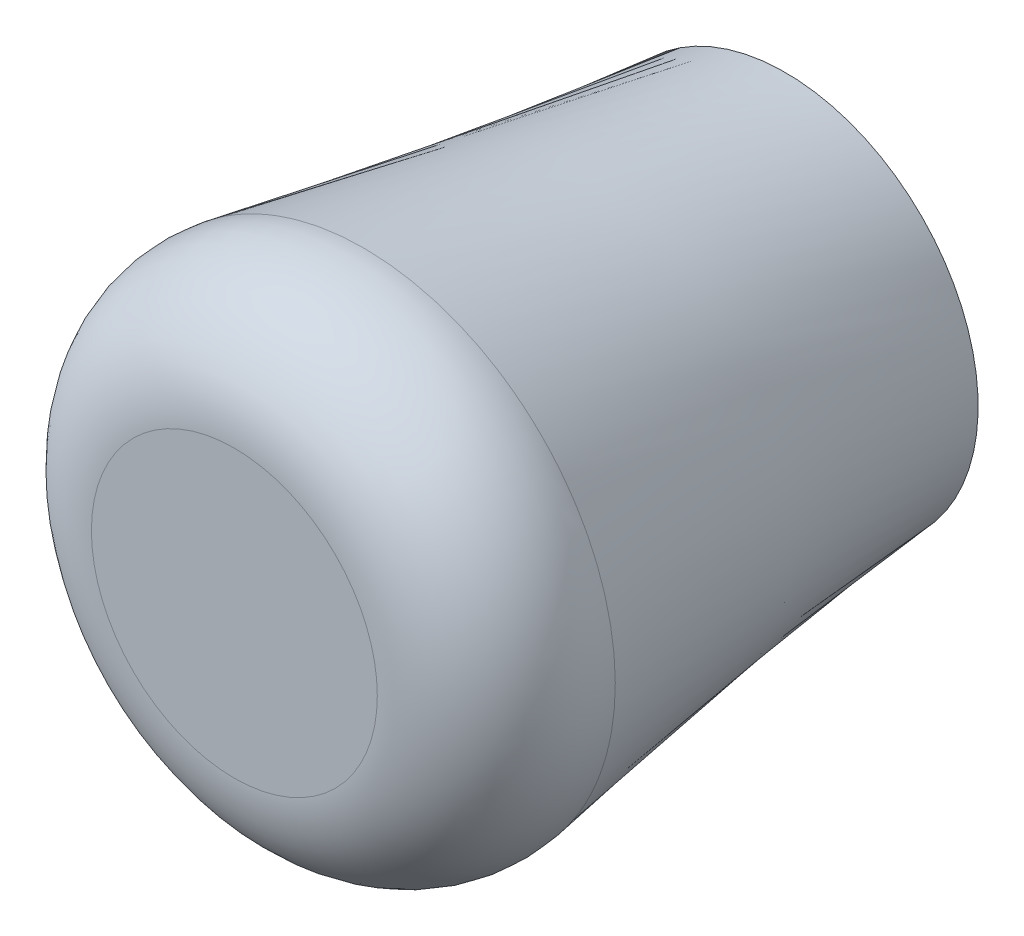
SolidWorks part; units mm, degrees
ref_plane "Alzado" through (0, 0, 0) normal (0, 0, 1) x (1, 0, 0)
ref_plane "Planta" through (0, 0, 0) normal (0, 1, 0) x (1, 0, 0)
ref_plane "Vista lateral" through (0, 0, 0) normal (1, 0, 0) x (0, 0, -1)
sketch "Sketch1" plane through (0, 0, 0) normal (0, 0, 1) x (1, 0, 0)
  circle A0 centre (0, 0) radius 7
  dimension "D1" = 14
ref_plane "Plane1" through (0, 0, 20) normal (0, 0, 1) x (1, 0, 0)
sketch "Sketch2" plane through (0, 0, 20) normal (0, 0, 1) x (1, 0, 0)
  circle A0 centre (0, 0) radius 10
  dimension "D1" = 20
loft "Loft1" add profiles "Sketch1", "Sketch2"
shell "Shell1" thickness 2
fillet "Fillet2" radius 4 1 edges at (10, 0, 20)
